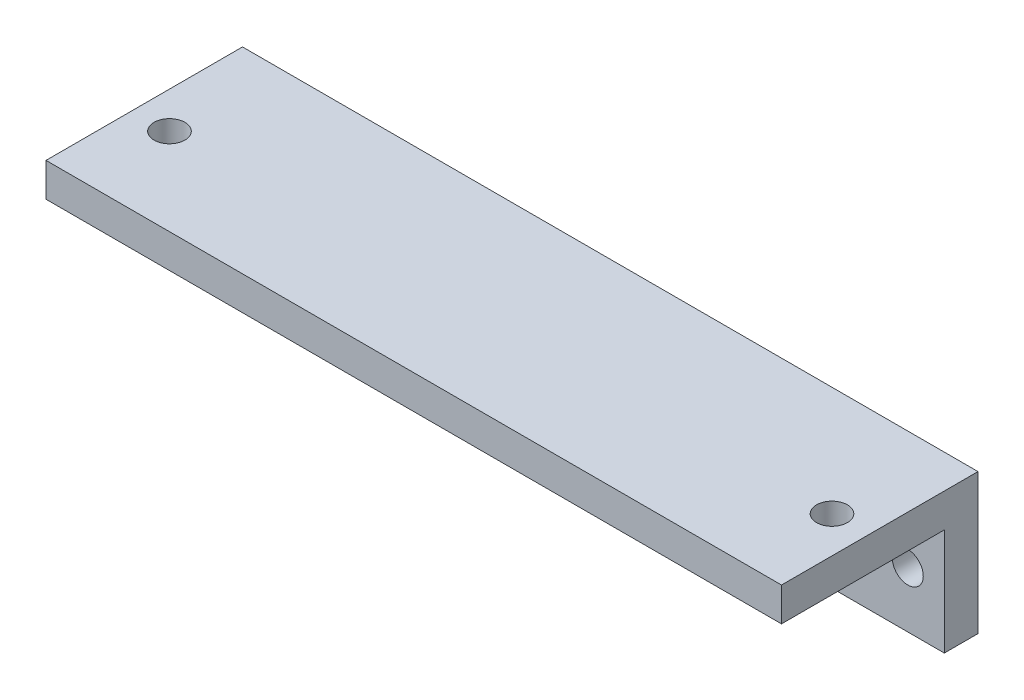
SolidWorks part; units mm, degrees
ref_plane "Front Plane" through (0, 0, 0) normal (0, 0, 1) x (1, 0, 0)
ref_plane "Top Plane" through (0, 0, 0) normal (0, 1, 0) x (1, 0, 0)
ref_plane "Right Plane" through (0, 0, 0) normal (1, 0, 0) x (0, 0, -1)
other "Configuration Table"
sketch "Sketch1" plane through (0, 0, 0) normal (0, 0, 1) x (1, 0, 0)
  line L1 (-65.5, 0) -> (65.5, 0)
  line L2 (-65.5, 0) -> (-65.5, -25)
  line L3 (-65.5, -25) -> (65.5, -25)
  line L4 (65.5, 0) -> (65.5, -25)
  dimension "D1" = 131
  dimension "D2" = 25
extrude "Extrude1" add sketch "Sketch1" along normal blind 6
sketch "Sketch2" plane through (0, 0, 0) normal (0, 1, 0) x (-1, 0, 0)
  line L0 (-65.5, 6) -> (-65.5, 0) construction
  line L1 (65.5, 0) -> (-65.5, 0)
  line L2 (65.5, 0) -> (65.5, 35)
  line L3 (65.5, 35) -> (-65.5, 35)
  line L4 (-65.5, 0) -> (-65.5, 35)
  dimension "D1" = 35
extrude "Extrude2" add sketch "Sketch2" against normal blind 6
hole_wizard "M5 Clearance Hole1" positions "Sketch4" profile "Sketch3" hole size "M5" standard "Ansi Metric"
sketch "Sketch4" plane through (0, 0, 6) normal (0, 0, 1) x (1, 0, 0)
  line L0 (-59, -15) -> (59, -15) construction
  line L1 (0, -15) -> (0, 0) construction
  line L2 (-65.5, -25) -> (65.5, -25) construction
  point P0 (59, -15)
  point P1 (-59, -15)
  dimension "D1" = 118
  dimension "D2" = 10
sketch "Sketch3" plane through (59, -15, 6) normal (1, 0, 0) x (0, -1, 0)
  line L0 (0, 0) -> (0, 11.6524)
  line L1 (0, 11.6524) -> (2.75, 10)
  line L2 (2.75, 10) -> (2.75, 0)
  line L5 (2.75, 0) -> (0, 0)
  line L10 (0, 11.6524) -> (-2.75, 10) construction
  line L11 (0, -6.35) -> (0, 107.95) construction
  dimension "Hole Dia." = 5.5
  dimension "Hole Depth" = 10
  dimension "Drill Angle" = 118
hole_wizard "M5 Clearance Hole2" positions "Sketch5" profile "Sketch6" hole size "M5" standard "Ansi Metric"
sketch "Sketch5" plane through (0.4151, -6, 44.5081) normal (0, -1, 0) x (1, 0, 0)
  line L0 (-59.4151, -25) -> (58.5849, -25) construction
  line L1 (-0.4151, -25) -> (-0.4151, 0) construction
  line L4 (-65.9151, -9.5081) -> (65.0849, -9.5081) construction
  point P0 (58.5849, -25)
  point P1 (-59.4151, -25)
  dimension "D1" = 118
  dimension "D2" = 15.4919
sketch "Sketch6" plane through (59, -6, 19.5081) normal (1, 0, 0) x (0, 0, -1)
  line L0 (0, 0) -> (0, 11.6524)
  line L1 (0, 11.6524) -> (2.75, 10)
  line L2 (2.75, 10) -> (2.75, 0)
  line L5 (2.75, 0) -> (0, 0)
  line L10 (0, 11.6524) -> (-2.75, 10) construction
  line L11 (0, -6.35) -> (0, 107.95) construction
  dimension "Hole Dia." = 5.5
  dimension "Hole Depth" = 10
  dimension "Drill Angle" = 118
